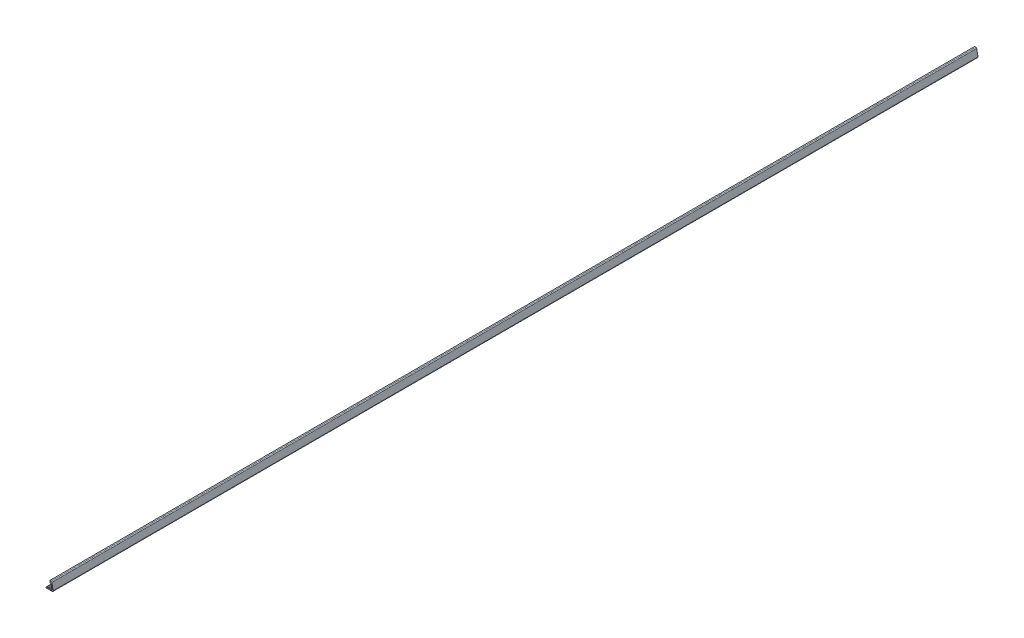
SolidWorks part; units mm, degrees
ref_plane "正面" through (0, 0, 0) normal (0, 0, 1) x (1, 0, 0)
ref_plane "平面" through (0, 0, 0) normal (0, 1, 0) x (1, 0, 0)
ref_plane "右側面" through (0, 0, 0) normal (1, 0, 0) x (0, 0, -1)
sketch "ｽｹｯﾁ2" plane through (0, 0, 0) normal (0, 0, 1) x (1, 0, 0)
  line L330 (3.1058, 0) -> (-3.1058, 0)
  line L331 (-1.5614, 1.8) -> (-1.3614, 1)
  line L332 (-1.5614, 1.8) -> (-2.3614, 1)
  line L333 (-2.5614, 1.8) -> (-2.3614, 1)
  line L334 (-2.5614, 1.8) -> (-3.4594, 0.9021)
  line L335 (-3.6058, 0.5485) -> (-3.6058, 0.5)
  line L336 (1.4386, 1.8) -> (1.6386, 1)
  line L337 (-0.5614, 1.8) -> (-1.3614, 1)
  line L338 (0.4386, 1.8) -> (0.6386, 1)
  line L339 (-0.5614, 1.8) -> (-0.3614, 1)
  line L340 (0.4386, 1.8) -> (-0.3614, 1)
  line L341 (1.4386, 1.8) -> (0.6386, 1)
  line L342 (4.0878, 1.1888) -> (2.742, 8.1888)
  line L343 (1.6386, 1) -> (2.2984, 1)
  line L344 (2.7896, 1.5937) -> (1.9084, 6.2144)
  line L345 (1.76, 9) -> (0.4963, 9)
  line L346 (1.4217, 6.6) -> (0.6963, 6.6)
  line L347 (0.4963, 9) -> (0.6963, 6.6)
  arc A192 (2.2984, 1) -> (2.7896, 1.5937) centre (2.2984, 1.5) ccw
  arc A193 (2.742, 8.1888) -> (1.76, 9) centre (1.76, 8) ccw
  arc A194 (1.9084, 6.2144) -> (1.4217, 6.6) centre (1.4217, 6.1) ccw
  arc A195 (-3.6058, 0.5) -> (-3.1058, 0) centre (-3.1058, 0.5) ccw
  arc A196 (-3.4594, 0.9021) -> (-3.6058, 0.5485) centre (-3.1058, 0.5485) ccw
  arc A197 (3.1058, 0) -> (4.0878, 1.1888) centre (3.1058, 1) ccw
extrude "押し出し1" add sketch "ｽｹｯﾁ2" along normal blind 1000
